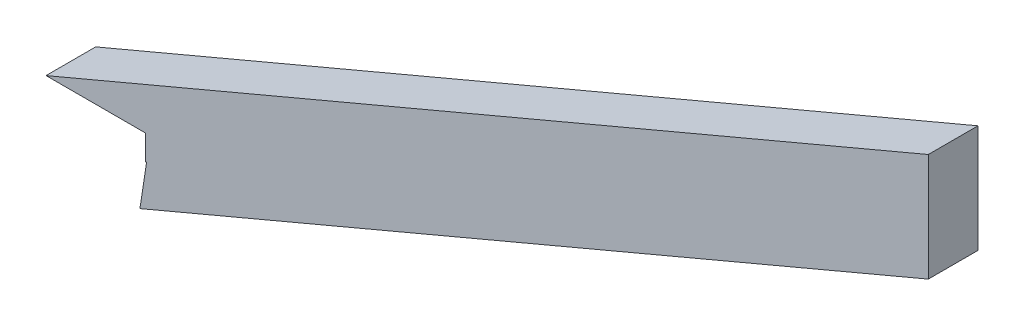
SolidWorks part; units mm, degrees
ref_plane "Front Plane" through (0, 0, 0) normal (0, 0, 1) x (1, 0, 0)
ref_plane "Top Plane" through (0, 0, 0) normal (0, 1, 0) x (1, 0, 0)
ref_plane "Right Plane" through (0, 0, 0) normal (1, 0, 0) x (0, 0, -1)
sketch "Sketch1" plane through (0, 0, 0) normal (0, 0, 1) x (1, 0, 0)
  line L0 (-914.4, 0) -> (914.4, 0) construction
  line L1 (0, 0) -> (0, 406.4) construction
  line L2 (0, 0) -> (0, -1981.2) construction
  line L3 (-1219.2, -1981.2) -> (1219.2, -1981.2) construction
  line L4 (-1219.2, -1981.2) -> (-914.4, 0) construction
  line L5 (-1116.4047, -1981.2) -> (-811.6047, 0) construction
  line L6 (-1118.7814, -1996.649) -> (-813.9814, -15.449) construction
  line L12 (-914.4, 0) -> (-914.4, 25.4) construction
  line L13 (-914.4, 25.4) -> (-812.8, 25.4) construction
  line L14 (-914.4, 0) -> (-812.8, 0) construction
  line L15 (-812.8, 25.4) -> (-812.8, 0) construction
  line L16 (-12.7, 0) -> (-12.7, 406.4) construction
  line L17 (-914.4, 25.4) -> (-12.7, 406.4)
  line L18 (-914.4, 25.4) -> (-812.8, 25.4)
  line L19 (-812.8, 25.4) -> (-812.8, 0)
  line L20 (-812.8, 0) -> (-811.6047, 0)
  line L21 (-811.6047, 0) -> (-818.427, -44.3454)
  line L22 (-12.7, 406.4) -> (-12.7, 296.1026)
  line L23 (-818.427, -44.3454) -> (-12.7, 296.1026)
  line L25 (-874.8556, -68.1885) -> (26.8444, 312.8115) construction
  point P4 (0, 0)
  point P10 (0, -1981.2)
  point P15 (-873.1363, -92.8433)
  point P16 (41.2637, 313.5567)
  dimension "D1" = 1828.8
  dimension "D2" = 406.4
  dimension "D3" = 1981.2
  dimension "D4" = 2438.4
  dimension "D6" = 25.4
  dimension "D7" = 101.6
  dimension "D5" = 101.6
  dimension "D8" = 12.7
  dimension "D9" = 101.6
extrude "Boss-Extrude2" add sketch "Sketch1" along normal blind 50.8
